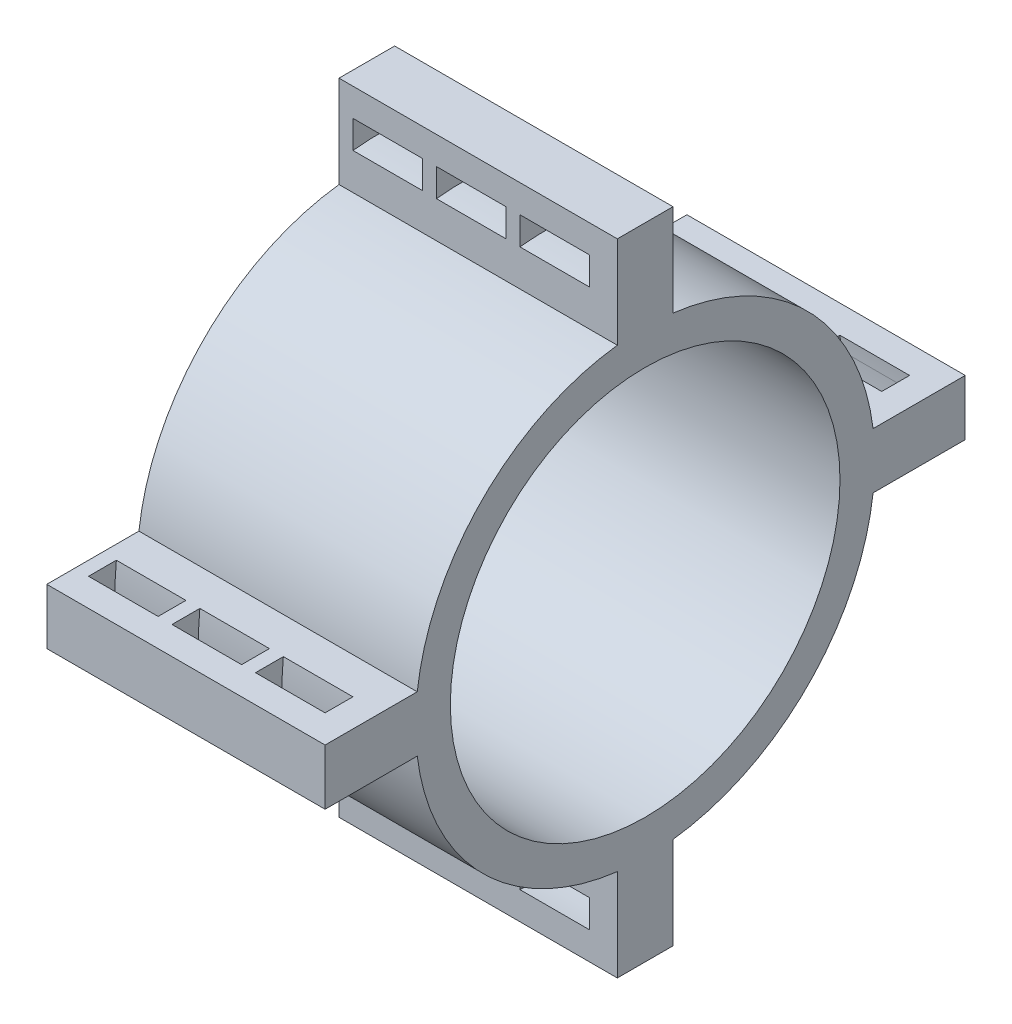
SolidWorks part; units mm, degrees
ref_plane "前视基准面" through (0, 0, 0) normal (0, 0, 1) x (1, 0, 0)
ref_plane "上视基准面" through (0, 0, 0) normal (0, 1, 0) x (1, 0, 0)
ref_plane "右视基准面" through (0, 0, 0) normal (1, 0, 0) x (0, 0, -1)
sketch "草图2" plane through (0, 0, 0) normal (1, 0, 0) x (0, 0, -1)
  line L1 (-2, 23) -> (2, 23)
  line L2 (2, 23) -> (2, 16.3783)
  line L3 (-2, 23) -> (-2, 16.3783)
  line L4 (23, -2) -> (16.3783, -2)
  line L5 (23, 2) -> (23, -2)
  line L6 (23, 2) -> (16.3783, 2)
  line L7 (-2, -23) -> (-2, -16.3783)
  line L8 (2, -23) -> (-2, -23)
  line L9 (2, -23) -> (2, -16.3783)
  line L10 (-23, 2) -> (-16.3783, 2)
  line L11 (-23, -2) -> (-23, 2)
  line L12 (-23, -2) -> (-16.3783, -2)
  circle A0 centre (0, 0) radius 14
  arc A1 (-2, 16.3783) -> (-16.3783, 2) centre (0, 0) ccw
  arc A2 (-16.3783, -2) -> (-2, -16.3783) centre (0, 0) ccw
  arc A3 (16.3783, 2) -> (2, 16.3783) centre (0, 0) ccw
  arc A4 (2, -16.3783) -> (16.3783, -2) centre (0, 0) ccw
  point P24 (0, 0)
  dimension "D1" = 28
  dimension "D2" = 33
  dimension "D3" = 23
  dimension "D4" = 4
  dimension "D6" = 4
extrude "凸台-拉伸1" add sketch "草图2" along normal blind 20
sketch "草图3" plane through (0, 0, 2) normal (0, 0, 1) x (1, 0, 0)
  line L0 (20, -16.3783) -> (20, -23) construction
  line L1 (18, -19) -> (13, -19)
  line L2 (18, -19) -> (18, -21)
  line L3 (18, -21) -> (13, -21)
  line L4 (13, -19) -> (13, -21)
  line L5 (20, -23) -> (0, -23) construction
  line L6 (12, -21) -> (7, -21)
  line L7 (12, -19) -> (7, -19)
  line L8 (12, -19) -> (12, -21)
  line L9 (7, -19) -> (7, -21)
  line L10 (6, -21) -> (1, -21)
  line L11 (6, -19) -> (1, -19)
  line L12 (6, -19) -> (6, -21)
  line L13 (1, -19) -> (1, -21)
  dimension "D1" = 2
  dimension "D2" = 5
  dimension "D3" = 2
  dimension "D4" = 2
  dimension "D5" = 3
sweep "切除-扫描1" cut profiles "草图3"
